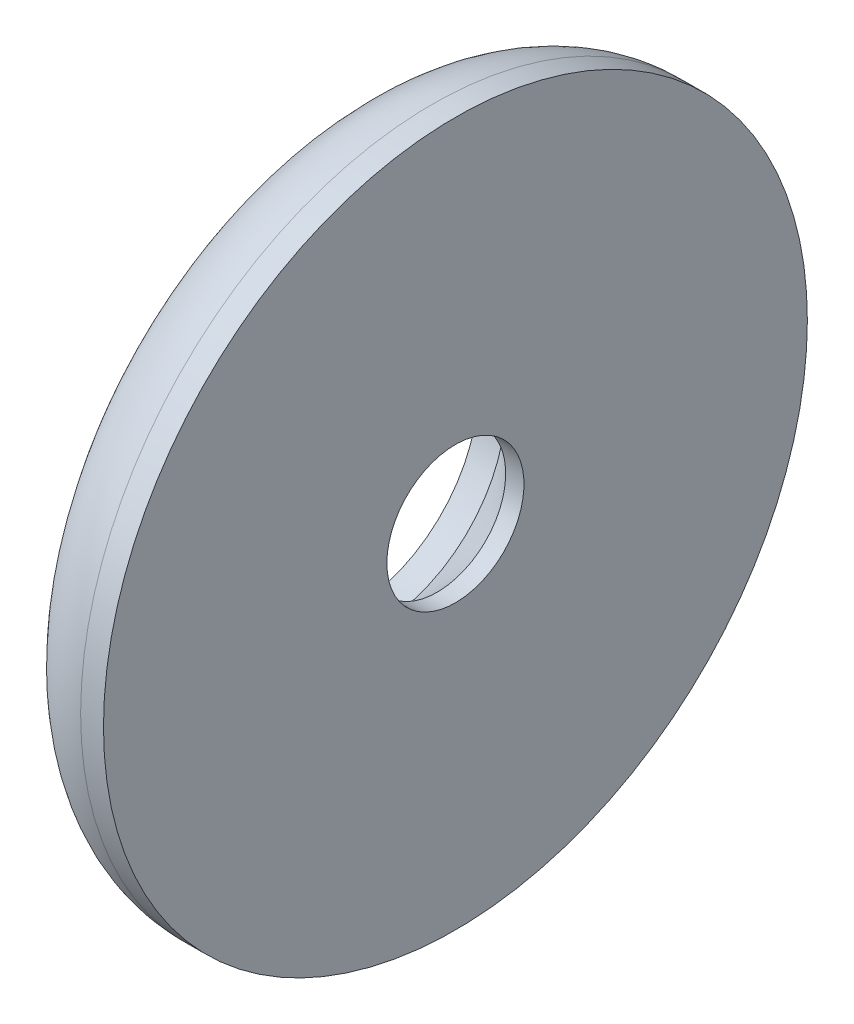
SolidWorks part; units mm, degrees
ref_plane "Plan de face" through (0, 0, 0) normal (0, 0, 1) x (1, 0, 0)
ref_plane "Plan de dessus" through (0, 0, 0) normal (0, 1, 0) x (1, 0, 0)
ref_plane "Plan de droite" through (0, 0, 0) normal (1, 0, 0) x (0, 0, -1)
sketch "Esquisse1" plane through (0, 0, 0) normal (0, 0, 1) x (1, 0, 0)
  line L0 (-1.15, 0) -> (1.15, 0) construction
  line L1 (1.15, 1.5) -> (1.15, 7.7)
  line L2 (1.15, 7.7) -> (-1.15, 7.7)
  line L3 (-1.15, 7.7) -> (-1.15, 2.8)
  line L4 (-0.55, 2.8) -> (0.75, 1.5)
  line L5 (-1.15, 2.8) -> (-0.55, 2.8)
  line L7 (0.75, 1.5) -> (1.15, 1.5)
  dimension "D1" = 15.4
  dimension "D2" = 2.3
  dimension "D3" = 45
  dimension "D5" = 0.6
  dimension "D6" = 5.6
  dimension "D7" = 3
revolve "Révolution1" add sketch "Esquisse1" angle 360 about L0
fillet "Congé1" radius 1.8 1 edges at (-1.15, 0, 7.7)
